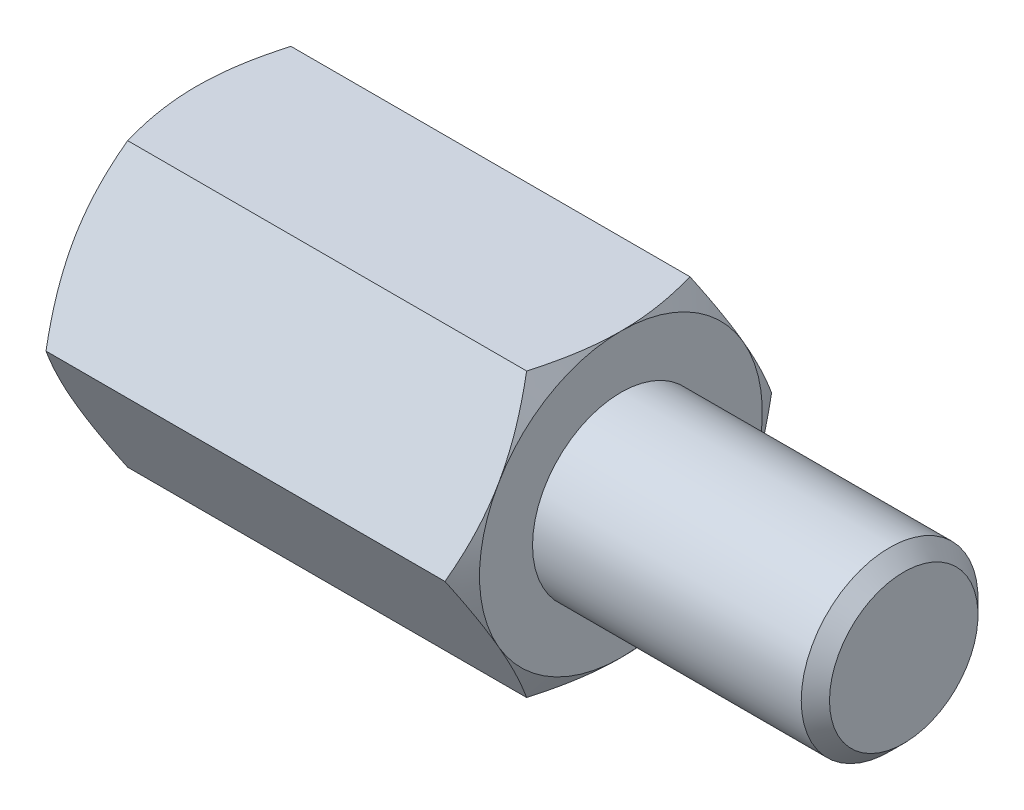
SolidWorks part; units mm, degrees
ref_plane "Front Plane" through (0, 0, 0) normal (0, 0, 1) x (1, 0, 0)
ref_plane "Top Plane" through (0, 0, 0) normal (0, 1, 0) x (1, 0, 0)
ref_plane "Right Plane" through (0, 0, 0) normal (1, 0, 0) x (0, 0, -1)
sketch "Sketch1" plane through (0, 0, 0) normal (1, 0, 0) x (0, 0, -1)
  line L1 (2.3094, 4) -> (-2.3094, 4)
  line L2 (-2.3094, 4) -> (-4.6188, 0)
  line L3 (-4.6188, 0) -> (-2.3094, -4)
  line L4 (-2.3094, -4) -> (2.3094, -4)
  line L5 (2.3094, -4) -> (4.6188, 0)
  line L6 (4.6188, 0) -> (2.3094, 4)
  circle A0 centre (0, 0) radius 4 construction
  dimension "D1" = 8
extrude "Extrude2" add sketch "Sketch1" along normal mid plane 12
sketch "Sketch2" plane through (0, 0, 0) normal (0, 0, 1) x (1, 0, 0)
  line L0 (-6, 4) -> (-4.5, 6.5981)
  line L1 (-6, 7) -> (-6, 4)
  line L3 (0, 0) -> (50000, 0) construction
  arc A0 (-4.5, 6.5981) -> (-6, 7) centre (-5.1962, 7) ccw
  dimension "D1" = 30
  dimension "D2" = 3
revolve "Cut-Revolve1" cut sketch "Sketch2" angle 360 about L3
mirror "Mirror1" about plane through (0, 0, 0) normal (1, 0, 0) of "Cut-Revolve1"
sketch "Sketch3" plane through (-6, 0, 0) normal (-1, 0, 0) x (0, 0, 1)
  circle A0 centre (0, 0) radius 2.1
  dimension "D1" = 4.2
extrude "Extrude3" cut sketch "Sketch3" against normal blind 8
sketch "Sketch4" plane through (0, 0, 0) normal (0, 0, 1) x (1, 0, 0)
  line L0 (2, 0) -> (2, 2.1)
  line L1 (5.6427, 0) -> (-5.6427, 0) construction
  line L2 (2, 2.1) -> (3.2124, 0)
  line L3 (3.2124, 0) -> (2, 0)
  line L4 (-6, 2) -> (-6, -2) construction
  point P4 (-6, 0)
  dimension "D1" = 30
  dimension "D2" = 2.1
  dimension "D3" = 8
revolve "Cut-Revolve2" cut sketch "Sketch4" angle 360 about L3
sketch "Sketch5" plane through (6, 0, 0) normal (1, 0, 0) x (0, 0, -1)
  circle A0 centre (0, 0) radius 2.5
  dimension "D1" = 5
extrude "Extrude4" add sketch "Sketch5" along normal blind 8
chamfer "Chamfer1" distance 0.4 angle 45 1 edges at (14, 0, -2.5)
equation "\"D2@Sketch4\" = \"D1@Sketch3\"/2"
